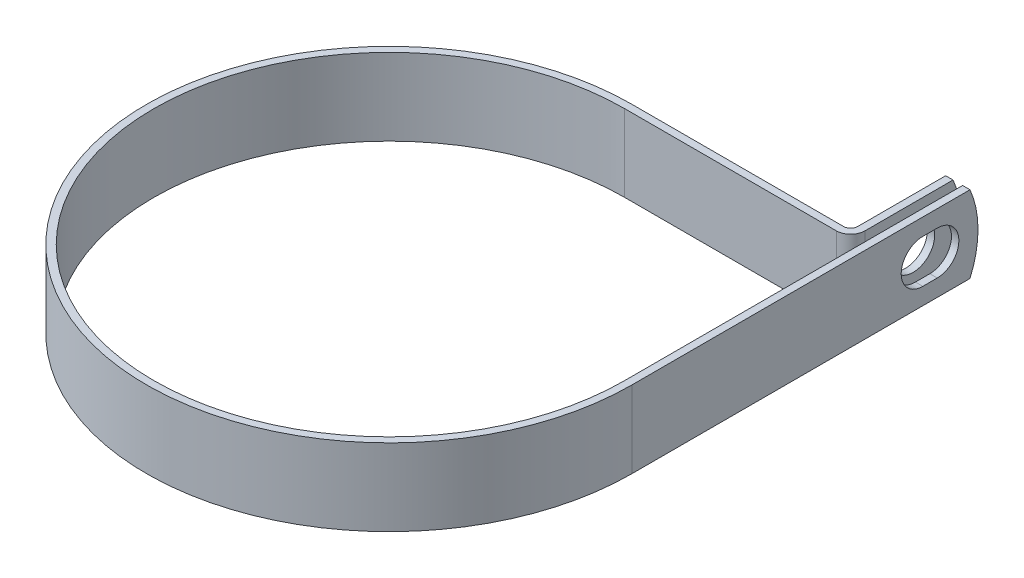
SolidWorks part; units mm, degrees
ref_plane "Front Plane" through (0, 0, 0) normal (0, 0, 1) x (1, 0, 0)
ref_plane "Top Plane" through (0, 0, 0) normal (0, 1, 0) x (1, 0, 0)
ref_plane "Right Plane" through (0, 0, 0) normal (1, 0, 0) x (0, 0, -1)
sketch "Sketch1" plane through (0, 0, 0) normal (0, 1, 0) x (1, 0, 0)
  line L0 (0, 38.8874) -> (34.9352, 38.8874)
  line L1 (38.8874, 0) -> (38.8874, 38.8874)
  line L2 (37.3126, 57.1246) -> (37.3126, 41.2648)
  line L5 (38.8874, 38.8874) -> (38.8874, 57.1246)
  arc A0 (0, 38.8874) -> (38.8874, 0) centre (0, 0) ccw
  arc A3 (34.9352, 38.8874) -> (37.3126, 41.2648) centre (34.9352, 41.2648) ccw
extrude "Extrude-Thin1" add sketch "Sketch1" along normal mid plane 12.7 thin
sketch "Sketch2" plane through (36.0934, 0, 0) normal (-1, 0, 0) x (0, 0, 1)
  line L0 (-57.1246, 6.35) -> (-57.1246, -6.35) construction
  line L7 (0, 6.35) -> (0, -6.35) construction
  circle A0 centre (-49.1998, 0) radius 3.5687
  point P2 (-57.1246, 0)
extrude "Cut-Extrude1" cut sketch "Sketch2" against normal up to surface (1.2192 mm away)
sketch "Sketch3" plane through (40.1066, 0, 0) normal (1, 0, 0) x (0, 0, -1)
  line L0 (48.006, 0) -> (50.3936, 0) construction
  line L1 (48.006, 3.5687) -> (50.3936, 3.5687)
  line L2 (48.006, -3.5687) -> (50.3936, -3.5687)
  line L3 (57.1246, 6.35) -> (57.1246, -6.35) construction
  arc A0 (48.006, 3.5687) -> (48.006, -3.5687) centre (48.006, 0) ccw
  arc A1 (50.3936, -3.5687) -> (50.3936, 3.5687) centre (50.3936, 0) ccw
  point P3 (49.1998, 0)
  point P8 (57.1246, 0)
  point P11 (44.4373, 0)
  point P12 (53.9623, 0)
extrude "Cut-Extrude2" cut sketch "Sketch3" against normal up to surface (1.2192 mm away)
sketch "Sketch4" plane through (36.0934, 0, 0) normal (-1, 0, 0) x (0, 0, 1)
  line L0 (-57.1246, 6.35) -> (-57.1246, -6.35)
  line L1 (-57.1246, 6.35) -> (-55.7993, 6.35)
  line L2 (-57.1246, 6.35) -> (-41.2648, 6.35) construction
  line L3 (-57.1246, -6.35) -> (-55.7993, -6.35)
  line L4 (-57.1246, -6.35) -> (-41.2648, -6.35) construction
  arc A0 (-55.7993, 6.35) -> (-55.7993, -6.35) centre (-41.2496, 0) ccw
extrude "Cut-Extrude3" cut sketch "Sketch4" against normal through all contours A0 M4 M5 | A0 L0 M2
equation "\"D1@Sketch3\" = \"D2@Sketch2\""
equation "\"D7@Sketch1\" = \"D3@Sketch2\" + \"D1@Sketch3\""
equation "\"D1@Sketch4\" = ( \"D1@Extrude-Thin1\" + .125 ) * 2"
equation "\"D2@Sketch1\"=1.95*\"D5@Extrude-Thin1\""
equation "\"D2@Sketch3\" = \"D1@Sketch2\""
